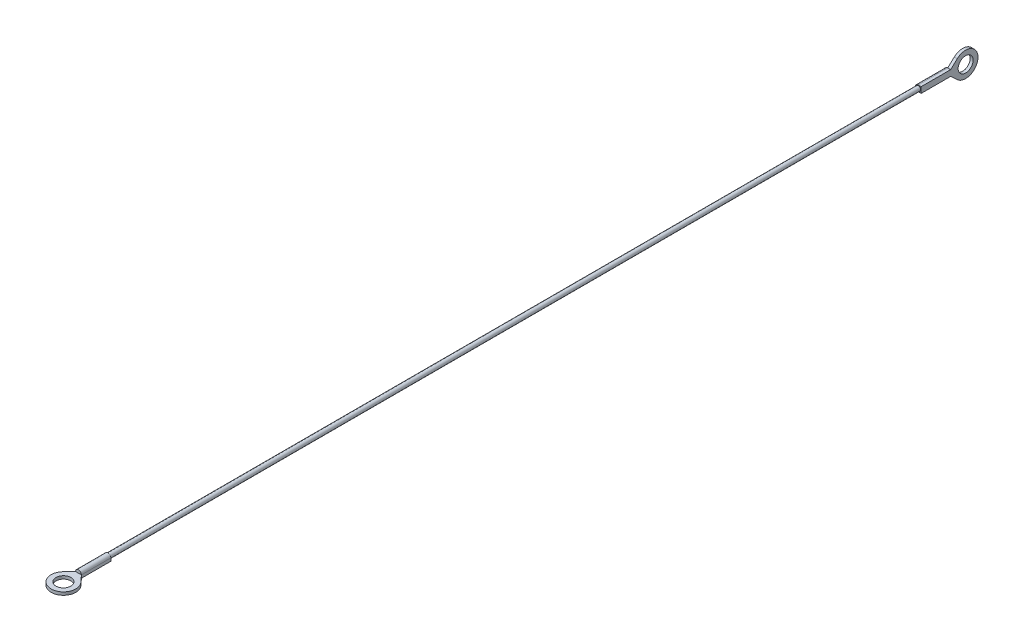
SolidWorks part; units mm, degrees
ref_plane "Front Plane" through (0, 0, 0) normal (0, 0, 1) x (1, 0, 0)
ref_plane "Top Plane" through (0, 0, 0) normal (0, 1, 0) x (1, 0, 0)
ref_plane "Right Plane" through (0, 0, 0) normal (1, 0, 0) x (0, 0, -1)
sketch "Sketch1" plane through (0, 0, 0) normal (0, 0, 1) x (1, 0, 0)
  circle A0 centre (0, 0) radius 0.795
extrude "Boss-Extrude1" add sketch "Sketch1" along normal mid plane 274.64
sketch "Sketch2" plane through (0, 0, 137.32) normal (0, 0, 1) x (1, 0, 0)
  line L0 (-0.995, 0) -> (-0.995, -0.995)
  line L1 (-0.995, -0.995) -> (0, -0.995)
  line L2 (0, -0.995) -> (0.995, -0.995)
  line L3 (0.995, -0.995) -> (0.995, 0)
  arc A0 (0.995, 0) -> (-0.995, 0) centre (0, 0) ccw
  dimension "D1" = 1.99
extrude "Boss-Extrude2" add sketch "Sketch2" along normal blind 10
sketch "Sketch3" plane through (0, -0.995, 0) normal (0, -1, 0) x (1, 0, 0)
  line L0 (0.995, 147.32) -> (3.0665, 149.5447)
  line L1 (-3.0665, 149.5447) -> (-0.995, 147.32)
  line L2 (-0.995, 147.32) -> (0.995, 147.32)
  arc A0 (3.0665, 149.5447) -> (-3.0665, 149.5447) centre (0, 152.4) ccw
  circle A1 centre (0, 152.4) radius 2.54
  point P8 (4.19, 152.4)
  point P9 (-4.19, 152.4)
  dimension "D1" = 5.08
  dimension "D2" = 8.38
  dimension "D3" = 152.4
extrude "Boss-Extrude3" add sketch "Sketch3" against normal blind 1.01
sketch "Sketch4" plane through (0, 0, -137.32) normal (0, 0, -1) x (-1, 0, 0)
  line L0 (0, 0.995) -> (-0.995, 0.995)
  line L1 (-0.995, 0.995) -> (-0.995, 0)
  line L2 (-0.995, 0) -> (-0.995, -0.995)
  line L3 (-0.995, -0.995) -> (0, -0.995)
  arc A0 (0, -0.995) -> (0, 0.995) centre (0, 0) ccw
  dimension "D1" = 1.99
extrude "Boss-Extrude4" add sketch "Sketch4" along normal blind 10
sketch "Sketch5" plane through (0.995, 0, 0) normal (1, 0, 0) x (0, 0, -1)
  line L0 (147.32, -0.995) -> (147.32, 0.995)
  line L1 (147.32, 0.995) -> (149.5447, 3.0665)
  line L2 (149.5447, -3.0665) -> (147.32, -0.995)
  arc A0 (149.5447, 3.0665) -> (149.5447, -3.0665) centre (152.4, 0) cw
  circle A1 centre (152.4, 0) radius 2.54
  point P8 (152.4, 4.19)
  point P9 (152.4, -4.19)
  dimension "D1" = 5.08
  dimension "D2" = 8.38
  dimension "D3" = 152.4
extrude "Boss-Extrude5" add sketch "Sketch5" against normal blind 1.01
